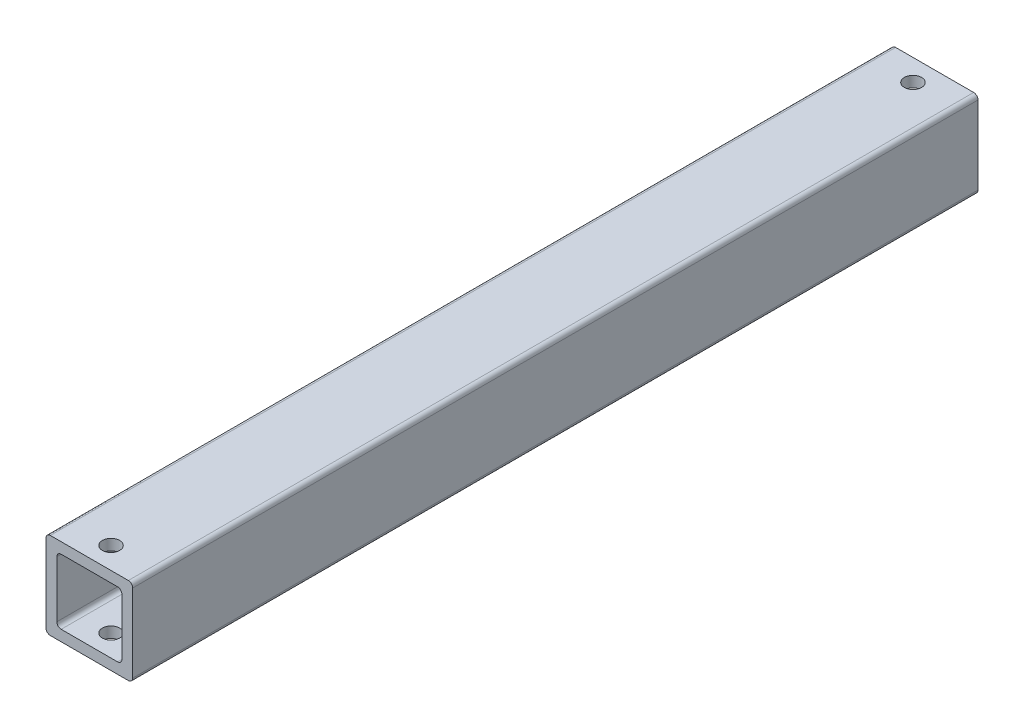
SolidWorks part; units mm, degrees
ref_plane "Front Plane" through (0, 0, 0) normal (0, 0, 1) x (1, 0, 0)
ref_plane "Top Plane" through (0, 0, 0) normal (0, 1, 0) x (1, 0, 0)
ref_plane "Right Plane" through (0, 0, 0) normal (1, 0, 0) x (0, 0, -1)
sketch "Sketch1" plane through (0, 0, 0) normal (0, 0, 1) x (1, 0, 0)
  line L1 (-22.86, -25.4) -> (22.86, -25.4)
  line L2 (-25.4, -22.86) -> (-25.4, 22.86)
  line L3 (-22.86, 25.4) -> (22.86, 25.4)
  line L4 (25.4, -22.86) -> (25.4, 22.86)
  line L5 (-16.51, -19.05) -> (16.51, -19.05)
  line L6 (-19.05, -16.51) -> (-19.05, 16.51)
  line L7 (-16.51, 19.05) -> (16.51, 19.05)
  line L8 (19.05, -16.51) -> (19.05, 16.51)
  arc A0 (-25.4, 22.86) -> (-22.86, 25.4) centre (-22.86, 22.86) cw
  arc A1 (-22.86, -25.4) -> (-25.4, -22.86) centre (-22.86, -22.86) cw
  arc A2 (25.4, -22.86) -> (22.86, -25.4) centre (22.86, -22.86) cw
  arc A3 (22.86, 25.4) -> (25.4, 22.86) centre (22.86, 22.86) cw
  arc A4 (16.51, 19.05) -> (19.05, 16.51) centre (16.51, 16.51) cw
  arc A5 (-19.05, 16.51) -> (-16.51, 19.05) centre (-16.51, 16.51) cw
  arc A6 (-16.51, -19.05) -> (-19.05, -16.51) centre (-16.51, -16.51) cw
  arc A7 (19.05, -16.51) -> (16.51, -19.05) centre (16.51, -16.51) cw
  point P11 (-25.4, 25.4)
  point P16 (25.4, -25.4)
  point P19 (25.4, 25.4)
  point P24 (-19.05, 19.05)
  point P27 (-19.05, -19.05)
  point P30 (19.05, -19.05)
  dimension "D9" = 2.54
  dimension "D1" = 50.8
  dimension "D2" = 50.8
  dimension "D3" = 38.1
  dimension "D4" = 25.4
  dimension "D5" = 25.4
  dimension "D6" = 19.05
  dimension "D7" = 19.05
  dimension "D8" = 38.1
extrude "Extrude1" add sketch "Sketch1" along normal mid plane 1371.6
sketch "Sketch2" plane through (0, 25.4, 0) normal (0, 1, 0) x (-1, 0, 0)
  line L1 (-25.4, 685.8) -> (-25.4, -685.8) construction
  circle A0 centre (0, 234.95) radius 5.08
  circle A1 centre (0, -234.95) radius 5.08
  circle A2 centre (0, 508) radius 5.08
  circle A3 centre (0, -508) radius 5.08
  dimension "D1" = 10.16
  dimension "D2" = 234.95
  dimension "D3" = 234.95
  dimension "D4" = 508
  dimension "D5" = 508
  dimension "D6" = 25.4
extrude "Cut-Extrude1" cut sketch "Sketch2" against normal through all
ref_plane "Plane1" through (0, 0, 247.65) normal (0, 0, 1) x (1, 0, 0)
ref_plane "Plane2" through (0, 0, -247.65) normal (0, 0, -1) x (-1, 0, 0)
sketch "Sketch3" plane through (0, 0, -247.65) normal (0, 0, -1) x (-1, 0, 0)
  line L1 (-28.1547, 27.7418) -> (34.6773, 27.7418)
  line L2 (-28.1547, 27.7418) -> (-28.1547, -28.4849)
  line L3 (-28.1547, -28.4849) -> (34.6773, -28.4849)
  line L4 (34.6773, 27.7418) -> (34.6773, -28.4849)
extrude "Cut-Extrude2" cut sketch "Sketch3" along normal blind 457.2
sketch "Sketch4" plane through (0, 0, 247.65) normal (0, 0, 1) x (1, 0, 0)
  line L1 (-32.3098, 33.3258) -> (58.7266, 33.3258)
  line L2 (-32.3098, 33.3258) -> (-32.3098, -37.9996)
  line L3 (-32.3098, -37.9996) -> (58.7266, -37.9996)
  line L4 (58.7266, 33.3258) -> (58.7266, -37.9996)
extrude "Cut-Extrude3" cut sketch "Sketch4" along normal blind 457.2
